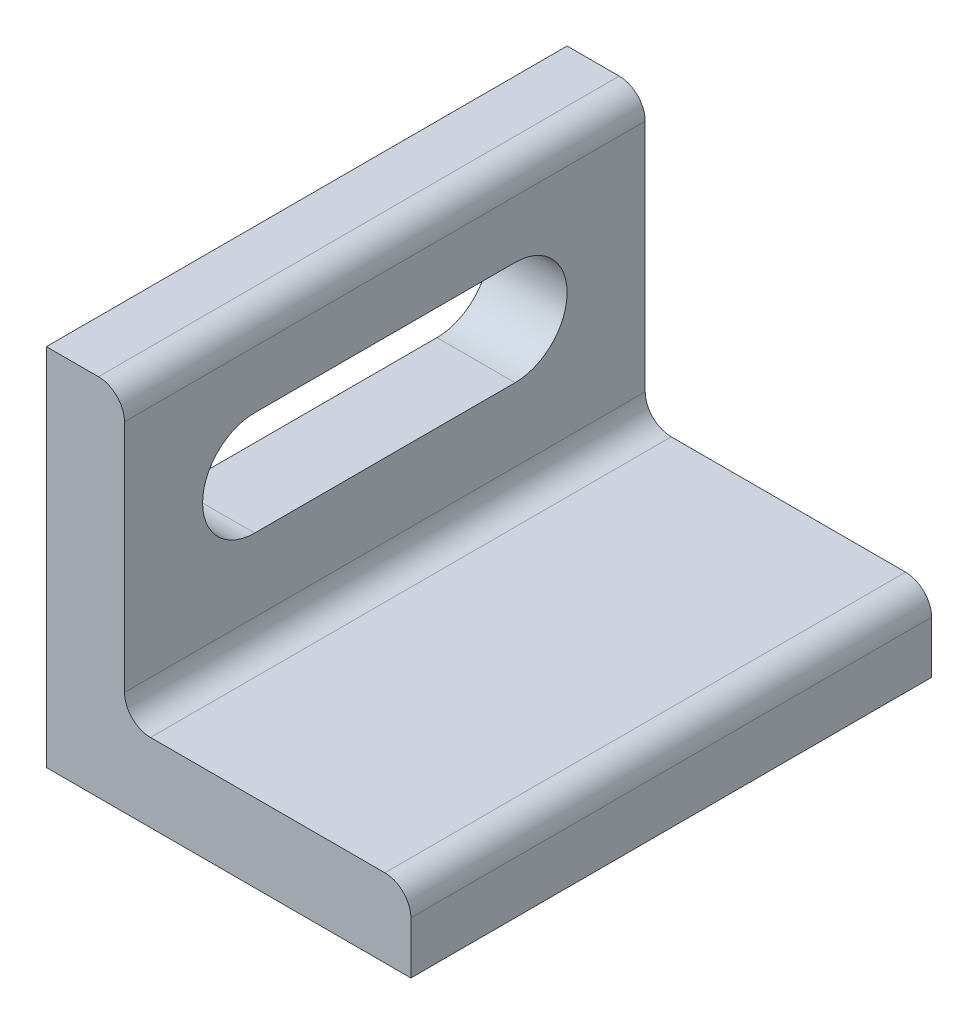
SolidWorks part; units mm, degrees
ref_plane "前视基准面" through (0, 0, 0) normal (0, 0, 1) x (1, 0, 0)
ref_plane "上视基准面" through (0, 0, 0) normal (0, 1, 0) x (1, 0, 0)
ref_plane "右视基准面" through (0, 0, 0) normal (1, 0, 0) x (0, 0, -1)
sketch "草图1" plane through (0, 0, 0) normal (0, 0, 1) x (1, 0, 0)
  line L0 (0, 0) -> (70, 0)
  line L1 (0, 0) -> (0, 70)
  line L2 (0, 70) -> (15, 70)
  line L3 (15, 70) -> (15, 15)
  line L4 (15, 15) -> (70, 15)
  line L5 (70, 15) -> (70, 0)
  line L6 (70, 0) -> (69.344, 0.7916)
  dimension "D1" = 70
  dimension "D2" = 70
  dimension "D3" = 15
  dimension "D4" = 15
extrude "凸台-拉伸1" add sketch "草图1" along normal blind 100 contours L0 L1 L2 L3 L4 L5
sketch "草图4" plane through (15, 0, 0) normal (1, 0, 0) x (0, 0, -1)
  line L0 (-75, 44) -> (-25, 44) construction
  line L1 (-75, 54) -> (-25, 54)
  line L2 (-75, 34) -> (-25, 34)
  line L3 (-100, 70) -> (-100, 15) construction
  line L4 (-100, 70) -> (0, 70) construction
  arc A0 (-75, 54) -> (-75, 34) centre (-75, 44) ccw
  arc A1 (-25, 34) -> (-25, 54) centre (-25, 44) ccw
  point P2 (-50, 44)
  dimension "D1" = 20
  dimension "D2" = 50
  dimension "D3" = 50
  dimension "D4" = 26
extrude "切除-拉伸1" cut sketch "草图4" against normal blind 20 contours L1 A1 L2 A0
fillet "圆角22" radius 5 3 edges at (70, 15, 50) (15, 70, 50) (15, 15, 50)
